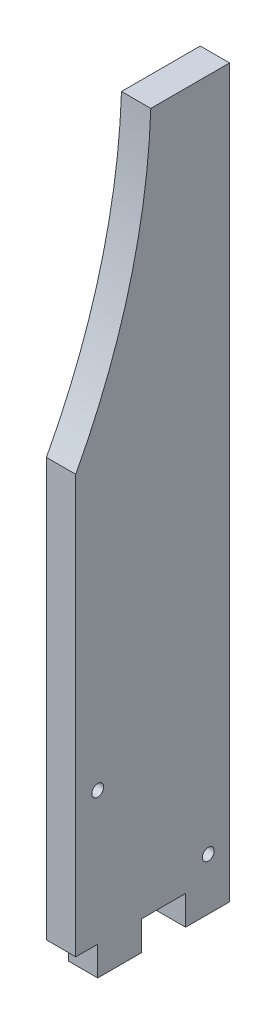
SolidWorks part; units mm, degrees
ref_plane "Front Plane" through (0, 0, 0) normal (0, 0, 1) x (1, 0, 0)
ref_plane "Top Plane" through (0, 0, 0) normal (0, 1, 0) x (1, 0, 0)
ref_plane "Right Plane" through (0, 0, 0) normal (1, 0, 0) x (0, 0, -1)
sketch "Sketch1" plane through (0, 0, 0) normal (1, 0, 0) x (0, 0, -1)
  line L0 (0, 0) -> (15, 0)
  line L1 (15, 0) -> (15, -20)
  line L2 (15, -20) -> (45, -20)
  line L3 (45, -20) -> (45, 0)
  line L4 (51.2327, 475.9175) -> (105, 475.9175)
  line L5 (51.2327, 475.9175) -> (51.2327, 0) construction
  line L6 (70.2327, 475.9175) -> (70.2327, 0) construction
  line L7 (0, 0) -> (0, 285.2504)
  line L8 (105, 0) -> (105, 475.9175)
  line L9 (45, 0) -> (75, 0)
  line L10 (75, 0) -> (75, -20)
  line L11 (75, -20) -> (105, -20)
  line L12 (105, -20) -> (105, 0)
  arc A0 (0, 285.2504) -> (51.2327, 475.9175) centre (-385, 490.9175) ccw
  circle A1 centre (15, 90.9175) radius 4.05
  circle A2 centre (90.4963, 15.4212) radius 4.05
  dimension "D1" = 8.1
  dimension "D2" = 436.4905
  dimension "D3" = 15
  dimension "D4" = 51.2327
  dimension "D5" = 70.2327
  dimension "D6" = 90.4963
  dimension "D7" = 105
  dimension "D8" = 385
  dimension "D9" = 15.4212
  dimension "D10" = 90.9175
  dimension "D11" = 285.2504
  dimension "D12" = 20
extrude "Boss-Extrude1" add sketch "Sketch1" along normal blind 20
